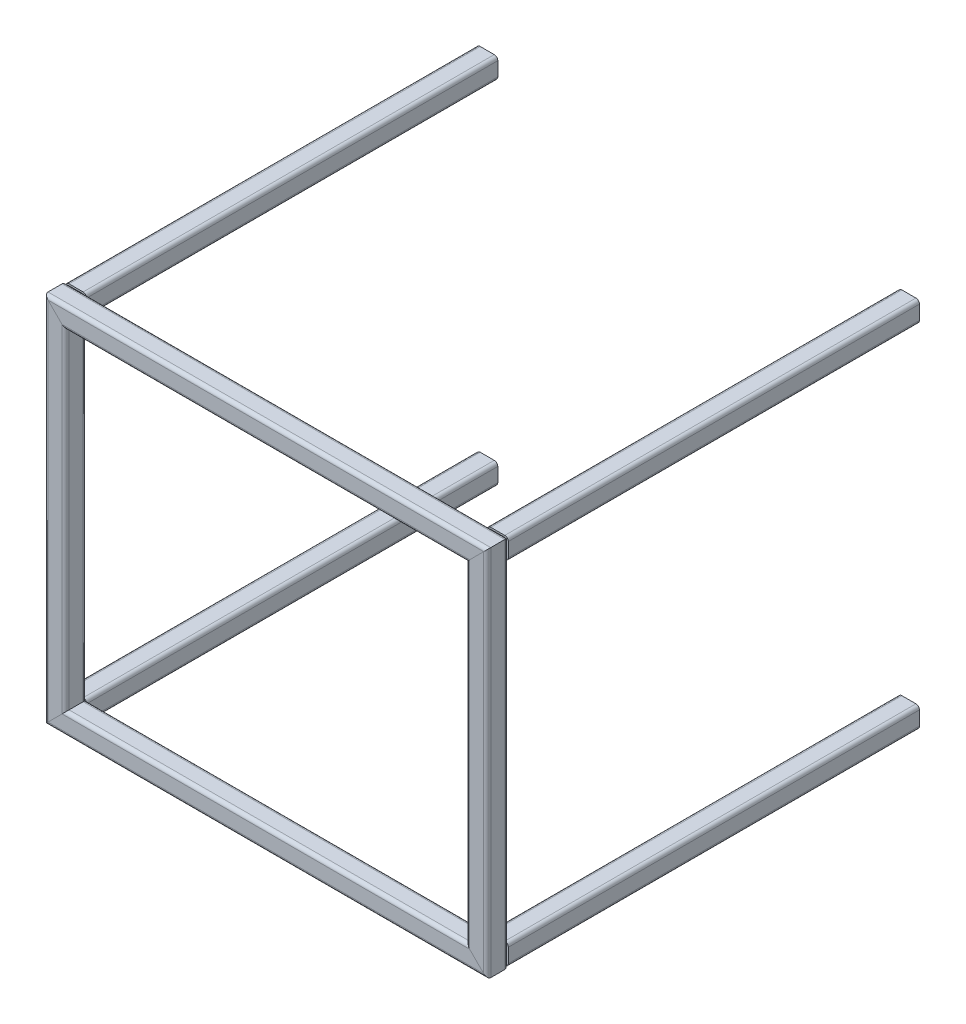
SolidWorks part; units mm, degrees
ref_plane "Front" through (0, 0, 0) normal (0, 0, 1) x (1, 0, 0)
ref_plane "Top" through (0, 0, 0) normal (0, 1, 0) x (1, 0, 0)
ref_plane "Right" through (0, 0, 0) normal (1, 0, 0) x (0, 0, -1)
sketch "Sketch1" plane through (0, 0, 0) normal (0, 0, 1) x (1, 0, 0)
  line L2 (-762, 635) -> (762, 635)
  line L3 (-762, 635) -> (-762, -635)
  line L4 (-762, -635) -> (762, -635)
  line L5 (762, 635) -> (762, -635)
  dimension "D1" = 1524
  dimension "D2" = 1270
  dimension "D3" = 762
  dimension "D4" = 635
ref_plane "Plane1" through (0, -635, 0) normal (0, 1, 0) x (-1, 0, 0)
sketch "Sketch2" plane through (0, -635, 0) normal (0, 1, 0) x (-1, 0, 0)
  line L0 (762, 0) -> (762, -1524)
  line L1 (-762, 0) -> (-762, -1524)
  dimension "D1" = 1524
ref_plane "Plane2" through (0, 635, 0) normal (0, 1, 0) x (-1, 0, 0)
sketch "Sketch3" plane through (0, 635, 0) normal (0, 1, 0) x (-1, 0, 0)
  line L0 (-762, 0) -> (-762, -1524)
  line L1 (762, 0) -> (762, -1524)
  line L2 (-762, 0) -> (-762, -1524) construction
  line L3 (762, 0) -> (762, -1524) construction
ref_plane "Plane3" through (-762, -635, 0) normal (0, 0, -1) x (-1, 0, 0)
other "Structural Member1"
ref_plane "Plane6" through (-762, 635, 0) normal (0, -1, 0) x (1, 0, 0)
sketch "Sketch13" plane through (-762, 635, 0) normal (0, -1, 0) x (1, 0, 0)
  line L0 (-25.4, -31.75) -> (25.4, -31.75)
  line L1 (-31.75, -25.4) -> (-31.75, 25.4)
  line L2 (25.4, 31.75) -> (-25.4, 31.75)
  line L3 (31.75, 25.4) -> (31.75, -25.4)
  line L4 (-25.4, -38.1) -> (25.4, -38.1)
  line L5 (-38.1, -25.4) -> (-38.1, 25.4)
  line L6 (25.4, 38.1) -> (-25.4, 38.1)
  line L7 (38.1, 25.4) -> (38.1, -25.4)
  line L8 (0, 0) -> (38.1, 0) construction
  line L9 (0, 0) -> (0, 38.1) construction
  arc A0 (38.1, 25.4) -> (25.4, 38.1) centre (25.4, 25.4) ccw
  arc A1 (25.4, -38.1) -> (38.1, -25.4) centre (25.4, -25.4) ccw
  arc A2 (-38.1, -25.4) -> (-25.4, -38.1) centre (-25.4, -25.4) ccw
  arc A3 (-25.4, 38.1) -> (-38.1, 25.4) centre (-25.4, 25.4) ccw
  arc A4 (-25.4, 31.75) -> (-31.75, 25.4) centre (-25.4, 25.4) ccw
  arc A5 (31.75, 25.4) -> (25.4, 31.75) centre (25.4, 25.4) ccw
  arc A6 (25.4, -31.75) -> (31.75, -25.4) centre (25.4, -25.4) ccw
  arc A7 (-31.75, -25.4) -> (-25.4, -31.75) centre (-25.4, -25.4) ccw
  point P3 (0, -38.1)
  point P5 (0, 0)
  point P33 (0, 0)
  point P36 (38.1, 0)
  point P37 (0, 38.1)
  dimension "D1" = 12.7
  dimension "Thickness" = 6.35
  dimension "V_leg" = 76.2
  dimension "H_leg" = 76.2
other "Structural Member2"
ref_plane "Plane7" through (-762, -635, 0) normal (0, 0, -1) x (-1, 0, 0)
sketch "Sketch14" plane through (-762, -635, 0) normal (0, 0, -1) x (-1, 0, 0)
  line L0 (-25.4, -31.75) -> (25.4, -31.75)
  line L1 (-31.75, -25.4) -> (-31.75, 25.4)
  line L2 (25.4, 31.75) -> (-25.4, 31.75)
  line L3 (31.75, 25.4) -> (31.75, -25.4)
  line L4 (-25.4, -38.1) -> (25.4, -38.1)
  line L5 (-38.1, -25.4) -> (-38.1, 25.4)
  line L6 (25.4, 38.1) -> (-25.4, 38.1)
  line L7 (38.1, 25.4) -> (38.1, -25.4)
  line L8 (0, 0) -> (38.1, 0) construction
  line L9 (0, 0) -> (0, 38.1) construction
  arc A0 (38.1, 25.4) -> (25.4, 38.1) centre (25.4, 25.4) ccw
  arc A1 (25.4, -38.1) -> (38.1, -25.4) centre (25.4, -25.4) ccw
  arc A2 (-38.1, -25.4) -> (-25.4, -38.1) centre (-25.4, -25.4) ccw
  arc A3 (-25.4, 38.1) -> (-38.1, 25.4) centre (-25.4, 25.4) ccw
  arc A4 (-25.4, 31.75) -> (-31.75, 25.4) centre (-25.4, 25.4) ccw
  arc A5 (31.75, 25.4) -> (25.4, 31.75) centre (25.4, 25.4) ccw
  arc A6 (25.4, -31.75) -> (31.75, -25.4) centre (25.4, -25.4) ccw
  arc A7 (-31.75, -25.4) -> (-25.4, -31.75) centre (-25.4, -25.4) ccw
  point P3 (0, -38.1)
  point P4 (-38.1, 0)
  point P5 (0, 0)
  point P6 (38.1, -38.1)
  point P7 (-38.1, -38.1)
  point P8 (-38.1, 38.1)
  point P33 (0, 0)
  point P35 (38.1, 38.1)
  point P36 (38.1, 0)
  point P37 (0, 38.1)
  dimension "D1" = 12.7
  dimension "Thickness" = 6.35
  dimension "V_leg" = 76.2
  dimension "H_leg" = 76.2
other "Structural Member3"
ref_plane "Plane8" through (-762, 635, 0) normal (0, 0, -1) x (-1, 0, 0)
sketch "Sketch15" plane through (-762, 635, 0) normal (0, 0, -1) x (-1, 0, 0)
  line L0 (-25.4, -31.75) -> (25.4, -31.75)
  line L1 (-31.75, -25.4) -> (-31.75, 25.4)
  line L2 (25.4, 31.75) -> (-25.4, 31.75)
  line L3 (31.75, 25.4) -> (31.75, -25.4)
  line L4 (-25.4, -38.1) -> (25.4, -38.1)
  line L5 (-38.1, -25.4) -> (-38.1, 25.4)
  line L6 (25.4, 38.1) -> (-25.4, 38.1)
  line L7 (38.1, 25.4) -> (38.1, -25.4)
  line L8 (0, 0) -> (38.1, 0) construction
  line L9 (0, 0) -> (0, 38.1) construction
  arc A0 (38.1, 25.4) -> (25.4, 38.1) centre (25.4, 25.4) ccw
  arc A1 (25.4, -38.1) -> (38.1, -25.4) centre (25.4, -25.4) ccw
  arc A2 (-38.1, -25.4) -> (-25.4, -38.1) centre (-25.4, -25.4) ccw
  arc A3 (-25.4, 38.1) -> (-38.1, 25.4) centre (-25.4, 25.4) ccw
  arc A4 (-25.4, 31.75) -> (-31.75, 25.4) centre (-25.4, 25.4) ccw
  arc A5 (31.75, 25.4) -> (25.4, 31.75) centre (25.4, 25.4) ccw
  arc A6 (25.4, -31.75) -> (31.75, -25.4) centre (25.4, -25.4) ccw
  arc A7 (-31.75, -25.4) -> (-25.4, -31.75) centre (-25.4, -25.4) ccw
  point P3 (0, -38.1)
  point P4 (-38.1, 0)
  point P5 (0, 0)
  point P6 (38.1, -38.1)
  point P7 (-38.1, -38.1)
  point P8 (-38.1, 38.1)
  point P33 (0, 0)
  point P35 (38.1, 38.1)
  point P36 (38.1, 0)
  point P37 (0, 38.1)
  dimension "D1" = 12.7
  dimension "Thickness" = 6.35
  dimension "V_leg" = 76.2
  dimension "H_leg" = 76.2
other "Trim/Extend1"
other "Trim/Extend2"
other "Trim/Extend3"
other "Trim/Extend4"
ref_plane "Plane9" through (-106.68, 0, 0) normal (1, 0, 0) x (0, 0, -1)
